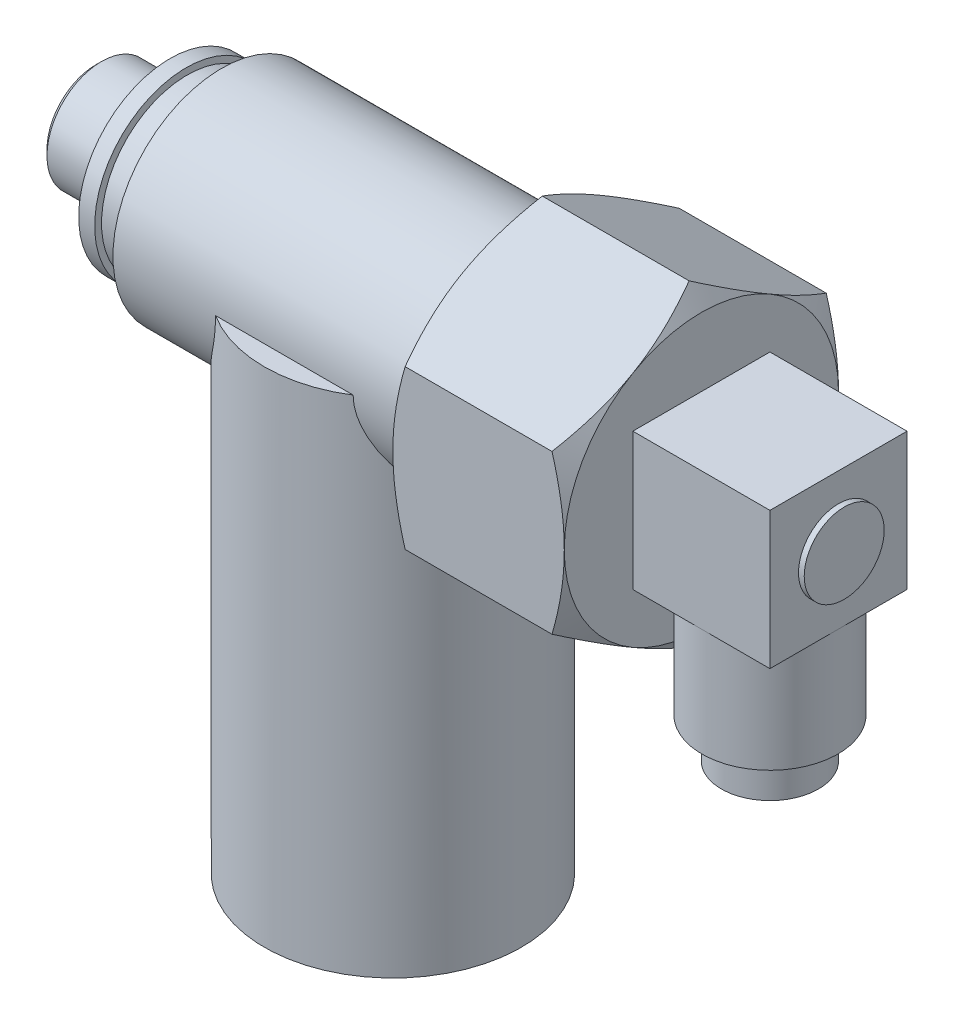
SolidWorks part; units mm, degrees
ref_plane "Plan de face" through (0, 0, 0) normal (0, 0, 1) x (1, 0, 0)
ref_plane "Plan de dessus" through (0, 0, 0) normal (0, 1, 0) x (1, 0, 0)
ref_plane "Plan de droite" through (0, 0, 0) normal (1, 0, 0) x (0, 0, -1)
sketch "Esquisse1" plane through (0, 0, 0) normal (0, 0, 1) x (1, 0, 0)
  line L0 (0, 0) -> (0, 4.775)
  line L1 (0, 4.775) -> (6.5, 4.775)
  line L2 (8, 4.775) -> (8, 7.5)
  line L3 (8, 7.5) -> (11, 7.5)
  line L4 (11, 7.5) -> (11, 9.5)
  line L5 (11, 9.5) -> (38, 9.5)
  line L6 (38, 9.5) -> (38, 0)
  line L7 (38, 0) -> (0, 0)
  line L8 (0, 0) -> (-31.6422, 0) construction
  line L9 (7.9, 4.775) -> (8, 4.775)
  line L11 (6.5, 4.775) -> (6.5, 8)
  line L12 (6.5, 8) -> (7.9, 8)
  line L13 (7.9, 4.775) -> (7.9, 8)
  dimension "D1" = 9.55
  dimension "D2" = 15
  dimension "D3" = 19
  dimension "D4" = 8
  dimension "D5" = 3
  dimension "D6" = 30
  dimension "D7" = 16
  dimension "D8" = 1.5
  dimension "D9" = 1.4
revolve "Révolution1" add sketch "Esquisse1" angle 360 about L8
sketch "Esquisse2" plane through (38, 0, 0) normal (1, 0, 0) x (0, 0, -1)
  line L1 (12, 6.9282) -> (0, 13.8564)
  line L2 (0, 13.8564) -> (-12, 6.9282)
  line L3 (-12, 6.9282) -> (-12, -6.9282)
  line L4 (-12, -6.9282) -> (0, -13.8564)
  line L5 (0, -13.8564) -> (12, -6.9282)
  line L6 (12, -6.9282) -> (12, 6.9282)
  circle A0 centre (0, 0) radius 12 construction
  dimension "D1" = 24
extrude "Extrusion1" add sketch "Esquisse2" along normal blind 15
sketch "Esquisse3" plane through (0, 0, 0) normal (0, 0, 1) x (1, 0, 0)
  line L0 (53, 13.8564) -> (53, 12)
  line L1 (53, 12) -> (51.9282, 13.8564)
  line L2 (53, 13.8564) -> (38, 13.8564) construction
  line L3 (51.9282, 13.8564) -> (53, 13.8564)
  line L4 (38, 13.8564) -> (39.0718, 13.8564)
  line L5 (39.0718, 13.8564) -> (38, 12)
  line L6 (38, 12) -> (38, 13.8564)
  line L7 (38, 6.9282) -> (38, -6.9282) construction
  line L8 (0, 0) -> (60.1813, 0) construction
  dimension "D1" = 30
  dimension "D2" = 24
revolve "Enlèvement de matière-Révolution1" cut sketch "Esquisse3" angle 360 about L8
sketch "Esquisse4" plane through (0, 0, 0) normal (0, 0, 1) x (1, 0, 0)
  line L0 (53, 0) -> (53, 10.3923) construction
  line L1 (65, 6) -> (53, 6)
  line L2 (65, 6) -> (65, -6)
  line L3 (65, -6) -> (53, -6)
  line L4 (53, 6) -> (53, -6)
  point P4 (53, 0)
  dimension "D1" = 12
extrude "Extrusion2" add sketch "Esquisse4" along normal mid plane 12
ref_plane "Plan1" through (59, 0, 0) normal (1, 0, 0) x (0, 0, -1)
sketch "Esquisse7" plane through (0, 0, 0) normal (0, 0, 1) x (1, 0, 0)
  line L0 (59, -6) -> (59, 22.4442) construction
  line L1 (59, -6) -> (64.95, -6)
  line L2 (64.95, -6) -> (64.95, -15.5)
  line L3 (64.95, -15.5) -> (62, -15.5)
  line L4 (62, -15.5) -> (62, -16.5)
  line L5 (62, -16.5) -> (63.25, -16.5)
  line L6 (63.25, -16.5) -> (63.25, -19)
  line L7 (63.25, -19) -> (61, -19)
  line L8 (59, -9) -> (59, -6)
  line L9 (59, -55) -> (59, 55) construction
  line L10 (53, -6) -> (65, -6) construction
  line L11 (65, 6) -> (53, 6) construction
  line L12 (61, -19) -> (61, -9)
  line L13 (61, -9) -> (59, -9)
  dimension "D1" = 11.9
  dimension "D2" = 21.5
  dimension "D3" = 2.5
  dimension "D4" = 3.5
  dimension "D5" = 8.5
  dimension "D6" = 6
  dimension "D7" = 10
  dimension "D8" = 4
revolve "Révolution6" add sketch "Esquisse7" angle 360 about L0
sketch "Esquisse8" plane through (0, 0, 0) normal (0, 0, 1) x (1, 0, 0)
  line L0 (26, -17.317) -> (26, 16.3117) construction
  line L1 (26, 0) -> (26, -37)
  line L2 (29, -47) -> (32, -47)
  line L3 (32, -47) -> (32, -45)
  line L4 (32, -45) -> (30, -45)
  line L5 (30, -45) -> (30, -44)
  line L6 (26, -37) -> (29, -37)
  line L7 (30, -44) -> (37.25, -44)
  line L8 (37.25, -44) -> (37.25, 0)
  line L9 (37.25, 0) -> (26, 0)
  line L10 (29, -37) -> (29, -47)
  line L12 (6.5, 8) -> (6.5, -8) construction
  dimension "D1" = 12
  dimension "D2" = 8
  dimension "D3" = 47
  dimension "D4" = 2
  dimension "D5" = 3
  dimension "D6" = 22.5
  dimension "D7" = 10
  dimension "D8" = 19.5
  dimension "D9" = 6
revolve "Révolution7" add sketch "Esquisse8" angle 360 about L0
chamfer "Chanfrein1" distance 0.5 angle 45 1 edges at (0, 0, -4.775)
sketch "Esquisse9" plane through (65, 0, 0) normal (1, 0, 0) x (0, 0, -1)
  circle A0 centre (0, 0) radius 3.5
  dimension "D1" = 7
extrude "Extrusion3" add sketch "Esquisse9" along normal blind 0.5
